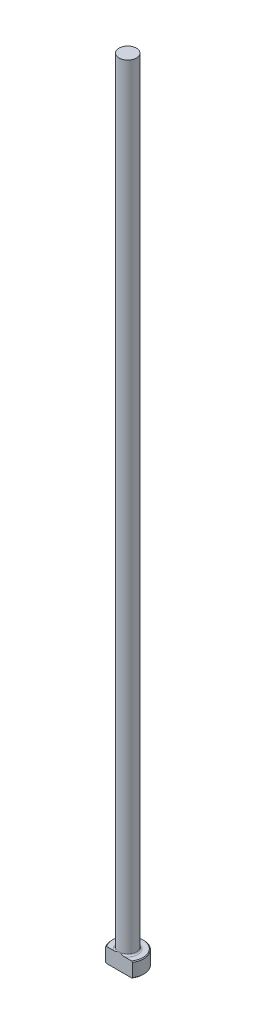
SolidWorks part; units mm, degrees
ref_plane "Front Plane" through (0, 0, 0) normal (0, 0, 1) x (1, 0, 0)
ref_plane "Top Plane" through (0, 0, 0) normal (0, 1, 0) x (1, 0, 0)
ref_plane "Right Plane" through (0, 0, 0) normal (1, 0, 0) x (0, 0, -1)
sketch "Sketch1" plane through (0, 0, 0) normal (0, 0, 1) x (1, 0, 0)
  line L0 (0, 259.9588) -> (0, -15.1925) construction
  line L1 (0, 0) -> (-5.1562, 0)
  line L2 (-5.1562, 0) -> (-5.1562, 4.7498)
  line L3 (-5.1562, 4.7498) -> (-2.7775, 4.7498)
  line L4 (-2.7775, 4.7498) -> (-2.7775, 254)
  line L5 (-2.7775, 254) -> (0, 254)
  line L6 (0, 254) -> (0, 0)
  dimension "L" = 254
  dimension "H" = 10.3124
  dimension "T" = 4.7498
  dimension "D" = 5.555
revolve "Revolve1" add sketch "Sketch1" angle 360 about L0
chamfer "Chamfer1" distance 0.254 angle 45 2 edges at (0, 4.7498, 5.1562) (0, 0, 5.1562)
fillet "Fillet1" radius 0.508 1 edges at (0, 4.7498, 2.7775)
sketch "Sketch2" plane through (0, 0, 0) normal (0, -1, 0) x (1, 0, 0)
  line L0 (-4.3442, 2.7775) -> (4.3442, 2.7775)
  arc A0 (4.3442, 2.7775) -> (-4.3442, 2.7775) centre (0, 0) ccw
  circle A1 centre (0, 0) radius 5.1562 construction
  circle A3 centre (0, 0) radius 2.7775 construction
extrude "KEY" cut sketch "Sketch2" against normal through all
sketch "Pocket Sketch" plane through (0, 0, 0) normal (0, 0, 1) x (1, 0, 0)
  line L0 (-5.5531, 0) -> (-5.5531, 4.7752)
  line L1 (-5.5531, 4.7752) -> (-3.7379, 4.7752)
  line L2 (-2.9759, 5.5372) -> (-2.9759, 22.225)
  line L3 (-2.9759, 22.225) -> (0, 22.225)
  line L4 (0, 22.225) -> (0, 0)
  line L5 (0, 0) -> (-5.5531, 0)
  line L6 (0, 12.6104) -> (0, -2.4989) construction
  line L7 (-5.1562, 4.4958) -> (-5.1562, 0.254) construction
  line L8 (4.9022, 4.7498) -> (-4.9022, 4.7498) construction
  line L9 (-2.7775, 254) -> (-2.7775, 5.2578) construction
  line L10 (-3.7379, 4.7752) -> (-2.9759, 5.5372)
  point P3 (-2.9759, 4.7752)
  dimension "D1" = 11.1061
  dimension "D2" = 0.3969
  dimension "D3" = 0.0254
  dimension "D4" = 0.1984
  dimension "D5" = 5.9519
  dimension "D6" = 22.225
